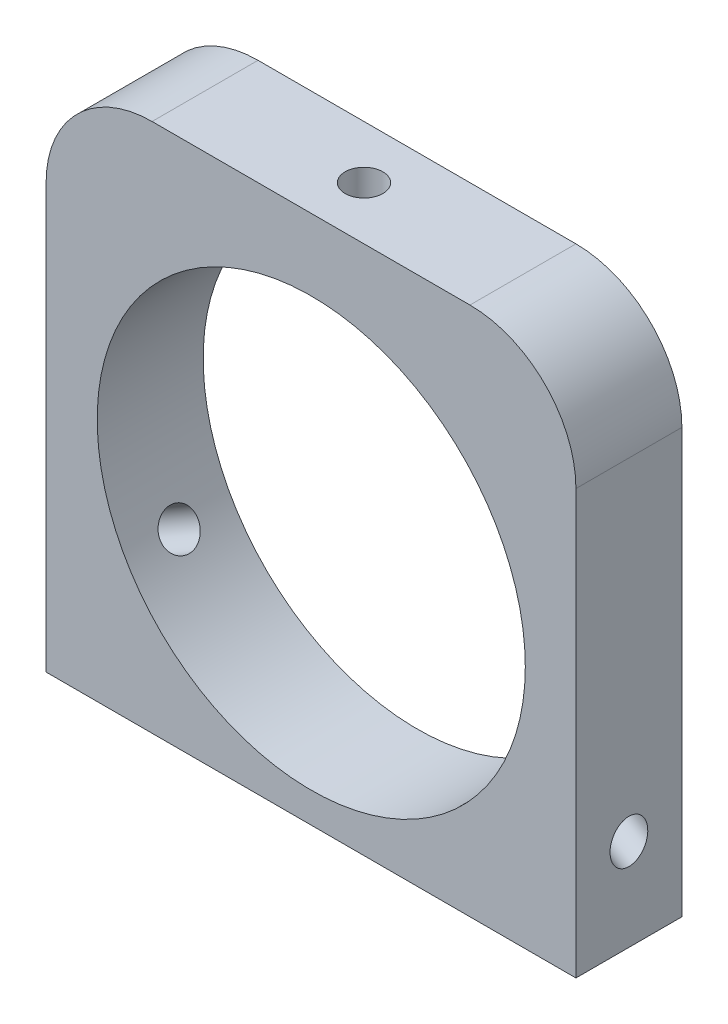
SolidWorks part; units mm, degrees
ref_plane "Front Plane" through (0, 0, 0) normal (0, 0, 1) x (1, 0, 0)
ref_plane "Top Plane" through (0, 0, 0) normal (0, 1, 0) x (1, 0, 0)
ref_plane "Right Plane" through (0, 0, 0) normal (1, 0, 0) x (0, 0, -1)
sketch "Sketch1" plane through (0, 0, 0) normal (0, 1, 0) x (1, 0, 0)
  line L1 (-15.875, 3.175) -> (15.875, 3.175)
  line L2 (-15.875, 3.175) -> (-15.875, -3.175)
  line L3 (-15.875, -3.175) -> (15.875, -3.175)
  line L4 (15.875, 3.175) -> (15.875, -3.175)
  line L5 (-15.875, 3.175) -> (15.875, -3.175) construction
  line L6 (-15.875, -3.175) -> (15.875, 3.175) construction
  point P0 (0, 0)
  dimension "D1" = 6.35
  dimension "D2" = 31.75
extrude "Boss-Extrude1" add sketch "Sketch1" along normal blind 31.75
hole_wizard "#4-40 Tapped Hole1" positions "Sketch2" profile "Sketch3" tap size "#4-40" standard "ANSI Inch"
sketch "Sketch2" plane through (0, 0, 0) normal (0, -1, 0) x (-1, 0, 0)
  line L1 (-15.875, -3.175) -> (-15.875, 3.175) construction
  point P0 (12.7, 0)
  point P2 (-12.7, 0)
  dimension "D1" = 25.4
  dimension "D3" = 3.175
sketch "Sketch3" plane through (-12.7, 0, 0) normal (1, 0, 0) x (0, 0, -1)
  line L0 (0, 0) -> (0, 5.5052)
  line L1 (0, 5.5052) -> (1.1303, 4.826)
  line L2 (1.1303, 4.826) -> (1.1303, 0)
  line L5 (1.1303, 0) -> (0, 0)
  line L10 (0, 5.5052) -> (-1.1303, 4.826) construction
  line L11 (0, -6.35) -> (0, 107.95) construction
  dimension "Tap Drill Dia." = 2.2606
  dimension "Tap Drill Depth" = 4.826
  dimension "Drill Angle" = 118
sketch "Sketch4" plane through (0, 0, 3.175) normal (0, 0, 1) x (1, 0, 0)
  circle A0 centre (0.0145, 14.6395) radius 12.827
  dimension "D1" = 25.654
extrude "Cut-Extrude1" cut sketch "Sketch4" against normal blind 8.128
fillet "Fillet1" radius 6.35 2 edges at (-15.875, 31.75, 0) (15.875, 31.75, 0)
ref_plane "Plane1" through (0, 34.29, 0) normal (0, 1, 0) x (1, 0, 0)
hole_wizard "#4-40 Tapped Hole3" positions "Sketch7" profile "Sketch8" tap size "#4-40" standard "ANSI Inch"
sketch "Sketch7" plane through (0, 34.29, 0) normal (0, 1, 0) x (1, 0, 0)
  point P0 (0, 0)
sketch "Sketch8" plane through (0, 34.29, 0) normal (1, 0, 0) x (0, 0, 1)
  line L0 (0, 0) -> (0, 13.3792)
  line L1 (0, 13.3792) -> (1.1303, 12.7)
  line L2 (1.1303, 12.7) -> (1.1303, 0)
  line L5 (1.1303, 0) -> (0, 0)
  line L10 (0, 13.3792) -> (-1.1303, 12.7) construction
  line L11 (0, -6.35) -> (0, 107.95) construction
  dimension "Tap Drill Dia." = 2.2606
  dimension "Tap Drill Depth" = 12.7
  dimension "Drill Angle" = 118
pattern_circular "CirPattern2" count 3 over 360 about axis through (0.0145, 14.6395, 3.175) along (0, 0, 1) of "#4-40 Tapped Hole3"
